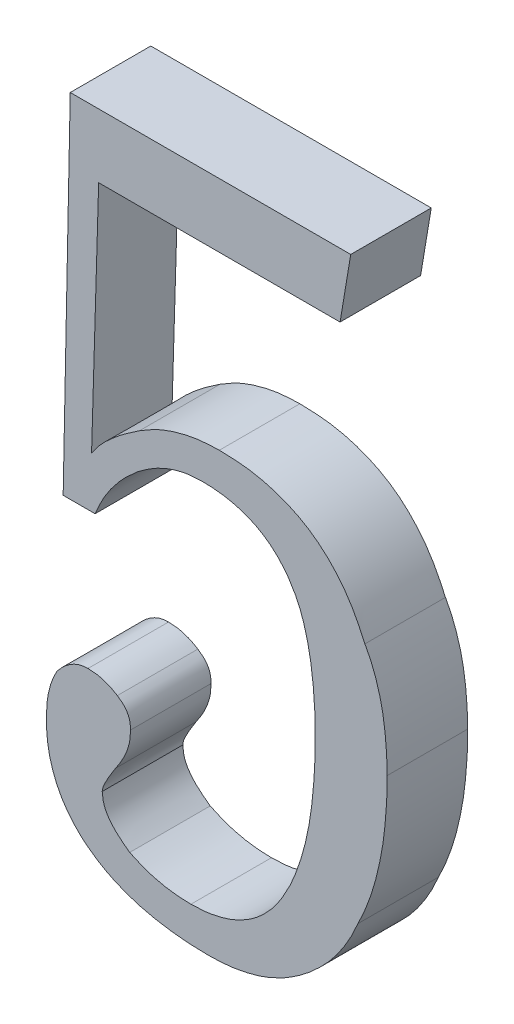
SolidWorks part; units mm, degrees
ref_plane "前基準面" through (0, 0, 0) normal (0, 0, 1) x (1, 0, 0)
ref_plane "上基準面" through (0, 0, 0) normal (0, 1, 0) x (1, 0, 0)
ref_plane "右基準面" through (0, 0, 0) normal (1, 0, 0) x (0, 0, -1)
sketch "草圖1" plane through (0, 0, 0) normal (0, 0, 1) x (1, 0, 0)
  text T0 "5" font "標楷體" height 25
extrude "填料-伸長1" add sketch "草圖1" along normal blind 3
